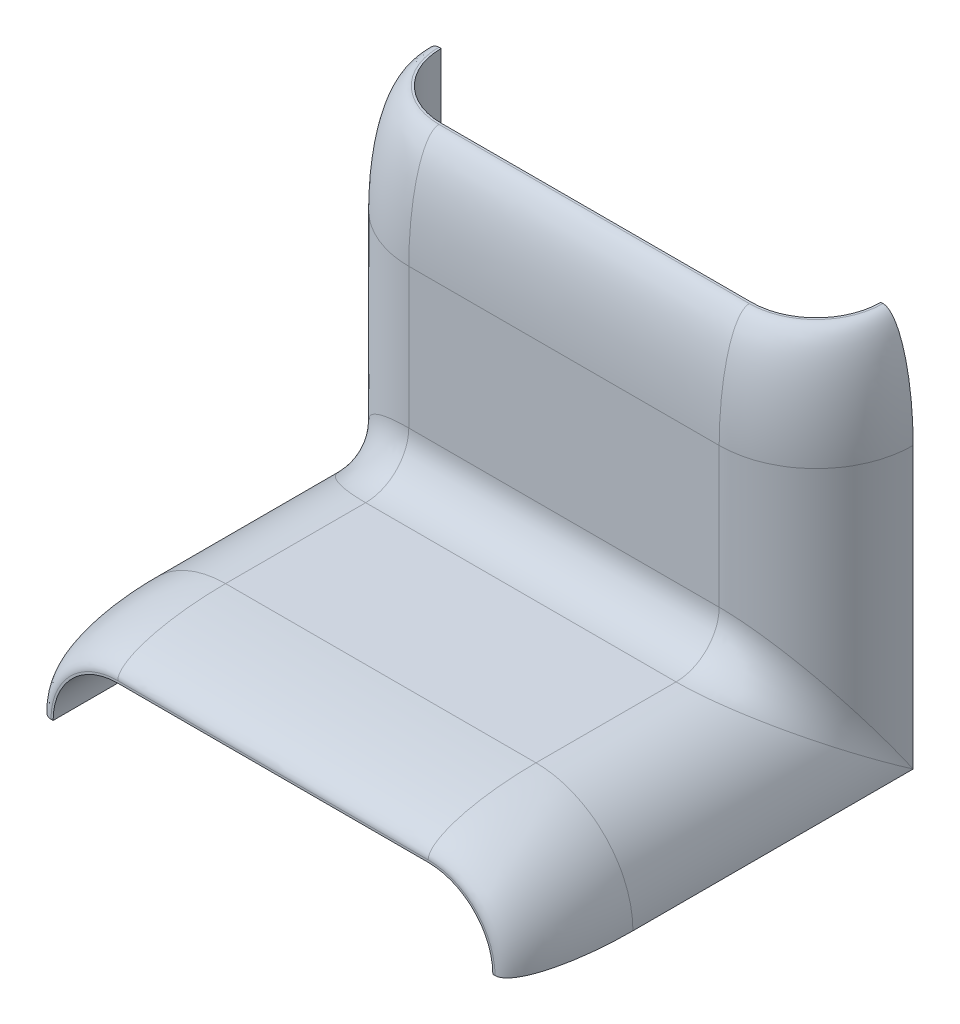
SolidWorks part; units mm, degrees
ref_plane "Спереди" through (0, 0, 0) normal (0, 0, 1) x (1, 0, 0)
ref_plane "Сверху" through (0, 0, 0) normal (0, 1, 0) x (1, 0, 0)
ref_plane "Сбоку" through (0, 0, 0) normal (1, 0, 0) x (0, 0, -1)
sketch "Эскиз1" plane through (0, 0, 0) normal (0, 0, 1) x (1, 0, 0)
  line L6 (-11.7, 0) -> (-10.2, 0)
  line L7 (10.2, 0) -> (11.7, 0)
  line L8 (0, 0) -> (0, 13.2712) construction
  line L9 (0, 0) -> (17.2362, 0) construction
  line L10 (-7.2, 3) -> (7.2, 3)
  line L11 (-7.2, 4.5) -> (7.2, 4.5)
  arc A0 (10.2, 0) -> (7.2, 3) centre (7.2, 0) ccw
  arc A1 (-7.2, 3) -> (-10.2, 0) centre (-7.2, 0) ccw
  arc A2 (11.7, 0) -> (7.2, 4.5) centre (7.2, 0) ccw
  arc A3 (-7.2, 4.5) -> (-11.7, 0) centre (-7.2, 0) ccw
  dimension "D3" = 4.5
  dimension "D4" = 3
  dimension "D1" = 23.4
  dimension "D2" = 1.5
  dimension "D5" = 4.5
sketch "Эскиз2" plane through (0, 0, 0) normal (1, 0, 0) x (0, 0, -1)
  line L0 (0, 0) -> (18, 0)
  line L1 (18, 0) -> (18, 18)
  dimension "D1" = 18
  dimension "D2" = 18
sweep "По траектории1" add profiles "Эскиз1" path "Эскиз2"
fillet "Скругление1" radius 2 3 edges at (-10.382, 3.182, -14.818) (10.382, 3.182, -14.818) (0, 4.5, -13.5)
fillet "Скругление2" radius 1.4 3 edges at (10.382, 18, -14.818) (-10.382, 18, -14.818) (0, 18, -13.5)
sketch "Эскиз3" plane through (0, 3, 0) normal (0, -1, 0) x (1, 0, 0)
  line L0 (0, 0) -> (0, -7) construction
  line L1 (-7.2, 0) -> (7.2, 0) construction
  circle A0 centre (0, -7) radius 2.4
  dimension "D1" = 4.8
  dimension "D2" = 7
extrude "Бобышка-Вытянуть1" add sketch "Эскиз3" along normal blind 1.5
sketch "Эскиз4" plane through (0, 0, -15) normal (0, 0, -1) x (-1, 0, 0)
  line L0 (0, 18) -> (0, 11) construction
  line L1 (7.2, 18) -> (-7.2, 18) construction
  circle A0 centre (0, 11) radius 2.4
  dimension "D2" = 4.8
  dimension "D1" = 7
extrude "Бобышка-Вытянуть2" add sketch "Эскиз4" along normal blind 1.5
chamfer "Фаска1" distance 0.3 angle 45 2 edges at (-2.4, 11, -16.5) (0, 1.5, -9.4)
fillet "Скругление3" radius 1.4 3 edges at (10.382, 3.182, 0) (-10.382, 3.182, 0) (0, 4.5, 0)
